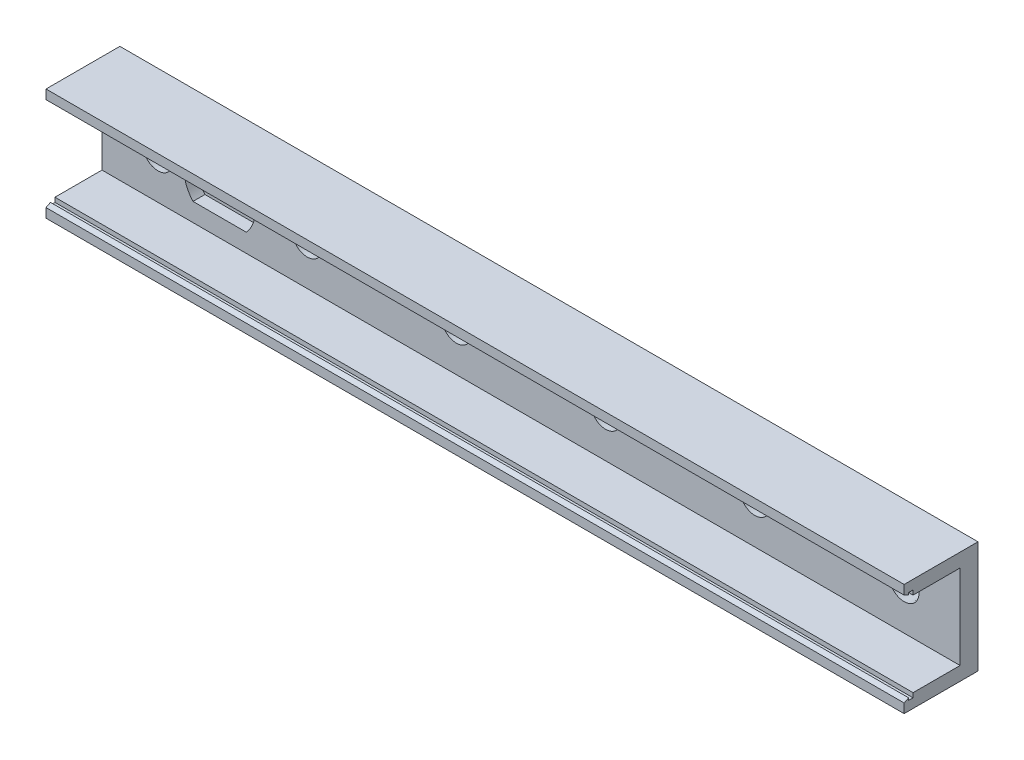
SolidWorks part; units mm, degrees
ref_plane "Front Plane" through (0, 0, 0) normal (0, 0, 1) x (1, 0, 0)
ref_plane "Top Plane" through (0, 0, 0) normal (0, 1, 0) x (1, 0, 0)
ref_plane "Right Plane" through (0, 0, 0) normal (1, 0, 0) x (0, 0, -1)
sketch "Sketch1" plane through (0, 0, 0) normal (0, 0, 1) x (1, 0, 0)
  line L1 (0, 0) -> (146.05, 0)
  line L2 (0, 0) -> (0, 19.05)
  line L3 (0, 19.05) -> (146.05, 19.05)
  line L4 (146.05, 0) -> (146.05, 19.05)
  dimension "D1" = 146.05
  dimension "D2" = 19.05
extrude "Boss-Extrude1" add sketch "Sketch1" along normal blind 3.048
sketch "Sketch2" plane through (0, 0, 3.048) normal (0, 0, 1) x (1, 0, 0)
  line L0 (0, 9.525) -> (146.05, 9.525) construction
  line L2 (0, 19.05) -> (0, 0) construction
  line L3 (146.05, 0) -> (146.05, 19.05) construction
  line L4 (15.487, 5.461) -> (24.5744, 5.461)
  line L5 (15.487, 13.589) -> (24.5744, 13.589)
  line L6 (0, 13.589) -> (146.05, 13.589) construction
  line L7 (0, 5.461) -> (146.05, 5.461) construction
  arc A0 (24.5744, 5.461) -> (24.5744, 13.589) centre (20.0307, 9.525) ccw
  arc A1 (15.487, 13.589) -> (15.487, 5.461) centre (20.0307, 9.525) ccw
  dimension "D1" = 12.192
  dimension "D2" = 4.064
  dimension "D3" = 4.064
extrude "Cut-Extrude1" cut sketch "Sketch2" against normal blind 2.032
sketch "Sketch3" plane through (0, 0, 1.016) normal (0, 0, 1) x (1, 0, 0)
  circle A0 centre (20.0307, 9.525) radius 3.556
  dimension "D1" = 7.112
extrude "Cut-Extrude2" cut sketch "Sketch3" against normal through all
sketch "Sketch4" plane through (0, 0, 3.048) normal (0, 0, 1) x (1, 0, 0)
  line L0 (0, 9.525) -> (146.05, 9.525) construction
  line L2 (0, 19.05) -> (0, 0) construction
  line L3 (146.05, 0) -> (146.05, 19.05) construction
  circle A0 centre (9.525, 9.525) radius 2.54
  circle A1 centre (34.925, 9.525) radius 2.54
  circle A2 centre (60.325, 9.525) radius 2.54
  circle A3 centre (85.725, 9.525) radius 2.54
  circle A4 centre (111.125, 9.525) radius 2.54
  circle A5 centre (136.525, 9.525) radius 2.54
  dimension "D2" = 5.08
  dimension "D1" = 9.525
  dimension "D4" = 25.4
  dimension "D3" = 6
extrude "Cut-Extrude3" cut sketch "Sketch4" against normal through all draft 3
sketch "Sketch5" plane through (0, 0, 0) normal (1, 0, 0) x (0, 0, -1)
  line L0 (-11.049, 16.7132) -> (-3.048, 16.7132)
  line L1 (-3.048, 19.05) -> (-12.573, 19.05)
  line L2 (-3.048, 19.05) -> (-3.048, 16.7132)
  line L3 (-12.573, 17.4752) -> (-11.811, 17.0942)
  line L4 (-12.573, 19.05) -> (-12.573, 17.4752)
  line L5 (-11.049, 2.3368) -> (-11.049, 1.5748)
  line L6 (-11.811, 17.0942) -> (-11.811, 17.4752)
  line L7 (-11.811, 17.4752) -> (-11.049, 17.4752)
  line L8 (-3.048, 9.525) -> (-15.2623, 9.525) construction
  line L9 (-3.048, 0) -> (-3.048, 19.05) construction
  line L10 (-11.049, 16.7132) -> (-11.049, 17.4752)
  line L11 (-11.811, 1.5748) -> (-11.049, 1.5748)
  line L12 (-11.811, 1.9558) -> (-11.811, 1.5748)
  line L13 (-12.573, 0) -> (-12.573, 1.5748)
  line L14 (-12.573, 1.5748) -> (-11.811, 1.9558)
  line L15 (-3.048, 0) -> (-3.048, 2.3368)
  line L16 (-3.048, 0) -> (-12.573, 0)
  line L17 (-11.049, 2.3368) -> (-3.048, 2.3368)
  dimension "D1" = 9.525
  dimension "D2" = 2.3368
  dimension "D3" = 0.762
  dimension "D4" = 0.762
  dimension "D5" = 0.762
  dimension "D6" = 0.381
  dimension "D7" = 26.565
  dimension "D8" = 15.9004
extrude "Boss-Extrude2" add sketch "Sketch5" along normal blind 146.05
